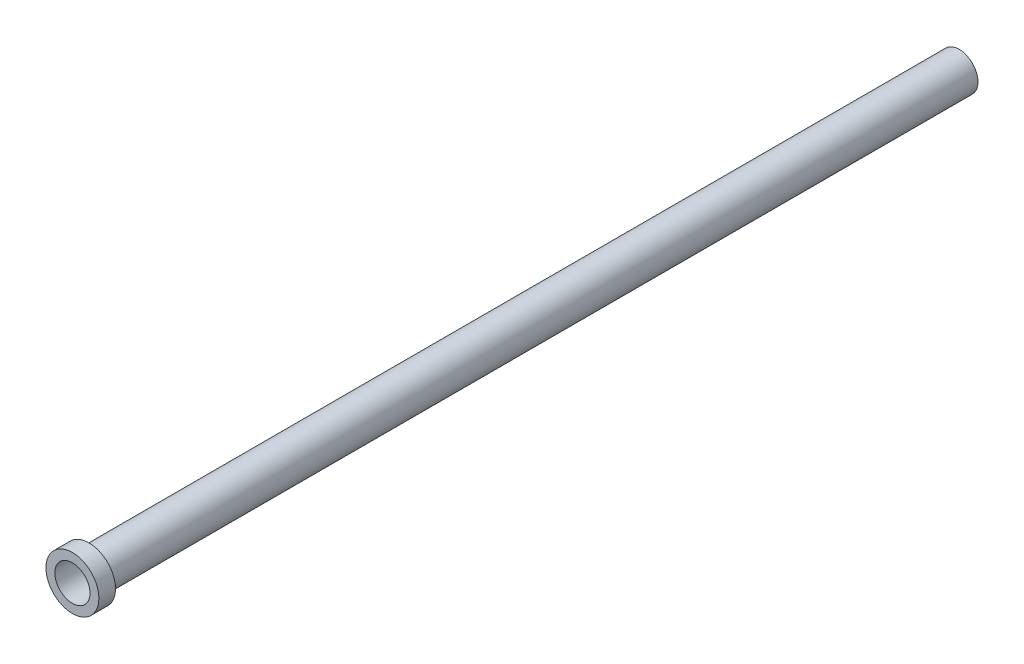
SolidWorks part; units mm, degrees
ref_plane "Front" through (0, 0, 0) normal (0, 0, 1) x (1, 0, 0)
ref_plane "Top" through (0, 0, 0) normal (0, 1, 0) x (1, 0, 0)
ref_plane "Right" through (0, 0, 0) normal (1, 0, 0) x (0, 0, -1)
sketch "Sketch1" plane through (0, 0, 0) normal (0, 0, 1) x (1, 0, 0)
  circle A0 centre (0, 0) radius 25.2095
  circle A1 centre (0, 0) radius 26.9875
  dimension "D1" = 50.419
  dimension "D2" = 53.975
extrude "Boss-Extrude1" add sketch "Sketch1" along normal blind 1270.635
sketch "Sketch2" plane through (0, 0, 1270.635) normal (0, 0, 1) x (1, 0, 0)
  circle A0 centre (0, 0) radius 25.2095
  circle A1 centre (0, 0) radius 37.9095
  dimension "D1" = 75.819
extrude "Boss-Extrude2" add sketch "Sketch2" against normal blind 23.8125
